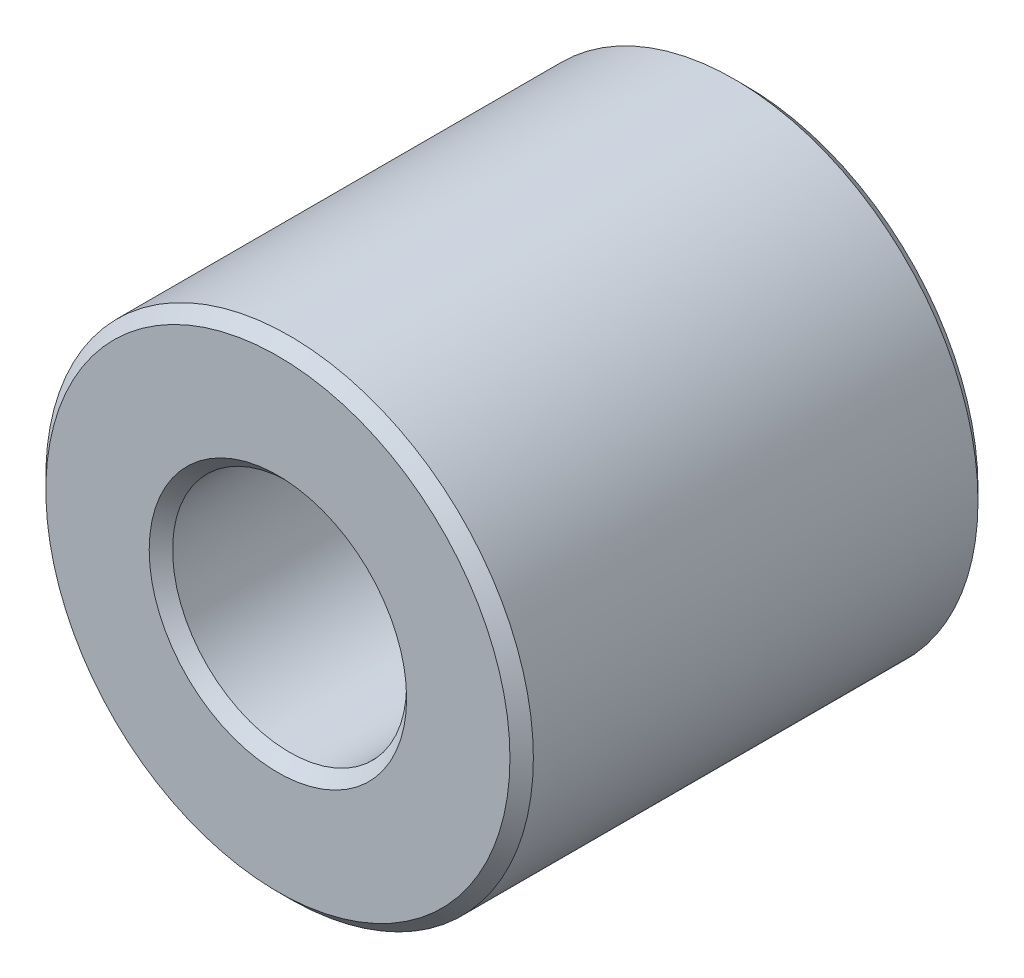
SolidWorks part; units mm, degrees
ref_plane "Front Plane" through (0, 0, 0) normal (0, 0, 1) x (1, 0, 0)
ref_plane "Top Plane" through (0, 0, 0) normal (0, 1, 0) x (1, 0, 0)
ref_plane "Right Plane" through (0, 0, 0) normal (1, 0, 0) x (0, 0, -1)
sketch "Sketch1" plane through (0, 0, 0) normal (0, 0, 1) x (1, 0, 0)
  circle A0 centre (0, 0) radius 12
  circle A1 centre (0, 0) radius 25
  dimension "D1" = 24
  dimension "D2" = 50
extrude "Boss-Extrude1" add sketch "Sketch1" along normal mid plane 48
chamfer "Chamfer1" distance 1.2 angle 45 4 edges at (12, 0, -24) (25, 0, -24) (12, 0, 24) (25, 0, 24)
